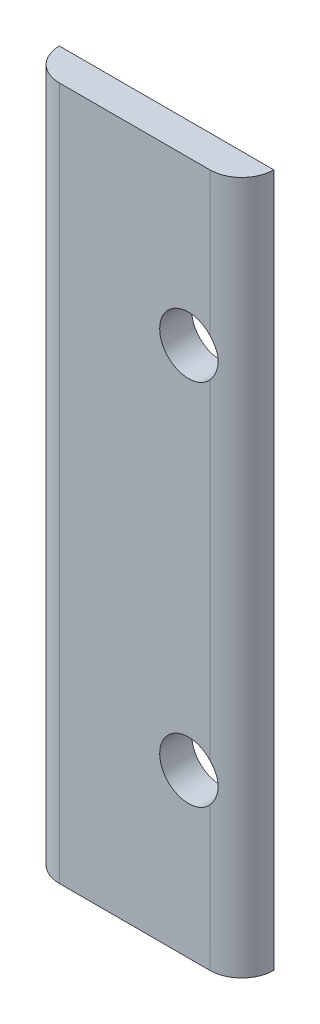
SolidWorks part; units mm, degrees
ref_plane "Front Plane" through (0, 0, 0) normal (0, 0, 1) x (1, 0, 0)
ref_plane "Top Plane" through (0, 0, 0) normal (0, 1, 0) x (1, 0, 0)
ref_plane "Right Plane" through (0, 0, 0) normal (1, 0, 0) x (0, 0, -1)
sketch "Sketch1" plane through (0, 0, 0) normal (0, 0, 1) x (1, 0, 0)
  line L0 (60, -5) -> (54, -5) construction
  line L1 (50, -9) -> (50, -24.5) construction
  line L2 (48, -26.5) -> (39.8952, -26.5) construction
  line L3 (39.8952, -26.5) -> (39.8952, -32.5) construction
  line L4 (39.8952, -32.5) -> (60, -32.5) construction
  line L5 (60, -32.5) -> (60, -5) construction
  line L6 (50, 25.5) -> (50, 9) construction
  line L7 (54, 5) -> (60, 5) construction
  line L8 (60, 5) -> (60, 32.5) construction
  line L9 (60, 32.5) -> (39.8952, 32.5) construction
  line L10 (39.8952, 32.5) -> (39.8952, 27.5) construction
  line L11 (39.8952, 27.5) -> (48, 27.5) construction
  line L12 (60, -5) -> (54, -5) construction
  line L13 (50, -9) -> (50, -24.5) construction
  line L14 (48, -26.5) -> (39.8952, -26.5) construction
  line L15 (39.8952, -26.5) -> (39.8952, -32.5) construction
  line L16 (39.8952, -32.5) -> (60, -32.5) construction
  line L17 (60, -32.5) -> (60, -5) construction
  line L18 (50, 25.5) -> (50, 9) construction
  line L19 (54, 5) -> (60, 5) construction
  line L20 (60, 5) -> (60, 32.5) construction
  line L21 (60, 32.5) -> (39.8952, 32.5) construction
  line L22 (39.8952, 32.5) -> (39.8952, 27.5) construction
  line L23 (39.8952, 27.5) -> (48, 27.5) construction
  arc A0 (54, -5) -> (50, -9) centre (54, -9) ccw construction
  arc A1 (48, -26.5) -> (50, -24.5) centre (48, -24.5) ccw construction
  arc A2 (50, 9) -> (54, 5) centre (54, 9) ccw construction
  arc A3 (50, 25.5) -> (48, 27.5) centre (48, 25.5) ccw construction
  arc A4 (54, -5) -> (50, -9) centre (54, -9) ccw construction
  arc A5 (48, -26.5) -> (50, -24.5) centre (48, -24.5) ccw construction
  arc A6 (50, 9) -> (54, 5) centre (54, 9) ccw construction
  arc A7 (50, 25.5) -> (48, 27.5) centre (48, 25.5) ccw construction
  circle A8 centre (55, 17.25) radius 2.5 construction
  circle A9 centre (55, -17.25) radius 2.5 construction
  circle A10 centre (55, 17.25) radius 2.5 construction
  circle A11 centre (55, -17.25) radius 2.5 construction
sketch "Sketch2" plane through (0, 0, 0) normal (0, 0, 1) x (1, 0, 0)
  line L0 (39.8952, 32.5) -> (39.8952, -32.5)
  line L1 (39.8952, -32.5) -> (60, -32.5)
  line L2 (60, -32.5) -> (60, 32.5)
  line L3 (60, 32.5) -> (39.8952, 32.5)
extrude "Boss-Extrude1" add sketch "Sketch2" along normal blind 3
sketch "Sketch4" plane through (0, 0, 0) normal (0, 0, -1) x (-1, 0, 0)
  circle A9 centre (-55, -17.25) radius 2.7
  circle A10 centre (-55, -17.25) radius 2.7
  circle A12 centre (-55, 17.25) radius 2.7
  circle A13 centre (-55, 17.25) radius 2.7
  dimension "D1" = 0.2
  dimension "D2" = 0.2
extrude "Cut-Extrude1" cut sketch "Sketch4" against normal through all
fillet "Fillet1" radius 3 2 edges at (39.8952, 0, 3) (60, 0, 3)
